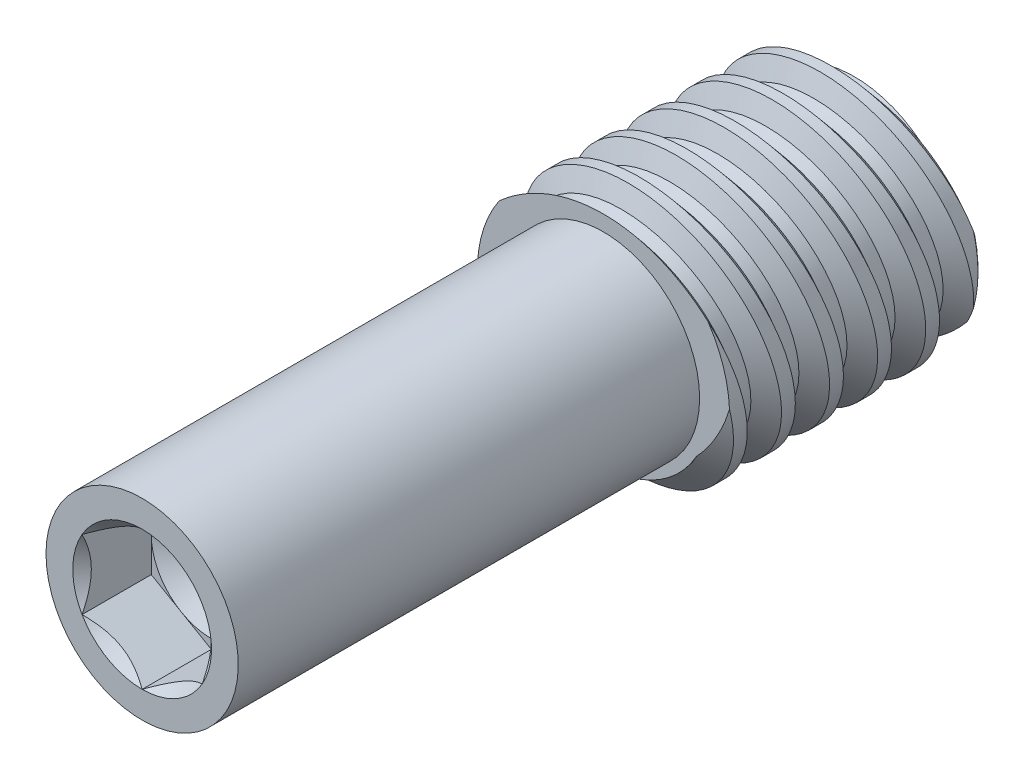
SolidWorks part; units mm, degrees
ref_plane "Front" through (0, 0, 0) normal (0, 0, 1) x (1, 0, 0)
ref_plane "Top" through (0, 0, 0) normal (0, 1, 0) x (1, 0, 0)
ref_plane "Right" through (0, 0, 0) normal (1, 0, 0) x (0, 0, -1)
sketch "Sketch22" plane through (0, 0, 0) normal (1, 0, 0) x (0, 0, -1)
  line L0 (-6.0181, 0) -> (-6.0181, 1.6662)
  line L1 (-6.0181, 1.6662) -> (-5.7264, 2.0828)
  line L2 (-5.7264, 2.0828) -> (5.704, 2.0828)
  line L3 (5.704, 2.0828) -> (6.6819, 1.1049)
  line L4 (6.6819, 1.1049) -> (6.0181, 0)
  line L5 (6.0181, 0) -> (-6.0181, 0)
  line L6 (6.0181, 0) -> (6.6819, 0) construction
  line L7 (6.6819, 0) -> (6.6819, 1.1049) construction
  line L8 (6.6819, -1.1049) -> (6.0181, 0) construction
  line L9 (-5.7264, -2.0828) -> (5.704, -2.0828) construction
  dimension "Screw Dia" = 4.1656
  dimension "Length" = 12.7
  dimension "D3" = 35
  dimension "Cup Point Dia" = 2.2098
  dimension "D5" = 118
  dimension "D6" = 45
  dimension "D7" = 3.3325
revolve "Revolve1" add sketch "Sketch22" angle 360 about L6
sketch "Sketch6" plane through (0, 0, 0) normal (1, 0, 0) x (0, 0, -1)
  line L0 (4.4558, 2.0828) -> (5.2495, -2.0828) construction
  line L1 (-5.7264, 2.0828) -> (5.704, 2.0828) construction
  line L2 (-5.7264, -2.0828) -> (5.704, -2.0828) construction
  line L3 (4.4558, 2.0828) -> (4.5532, 2.1014) construction
  line L4 (5.0723, 1.7629) -> (4.8773, 1.7258)
  line L5 (4.8773, 1.7258) -> (4.5532, 2.1014)
  line L6 (5.0723, 1.7629) -> (5.2355, 2.2314)
  line L7 (5.2355, 2.2314) -> (4.5532, 2.1014)
  line L8 (4.9103, 2.0828) -> (5.704, -2.0828) construction
  line L9 (6.1586, 0.1622) -> (4.4558, -0.1622) construction
  line L10 (4.8944, 2.1664) -> (4.9748, 1.7443) construction
  line L13 (4.4558, -2.0828) -> (4.4558, 2.0828) construction
  line L14 (4.4558, -2.0828) -> (5.2495, -2.0828) construction
  line L15 (5.2495, -2.0828) -> (5.704, -2.0828) construction
  line L18 (4.4558, 2.0828) -> (4.9103, 2.0828) construction
  point P18 (5.3072, 0)
  dimension "D1" = 0.7937
  dimension "D2" = 0.1984
  dimension "D3" = 60
  dimension "D4" = 0.0992
  dimension "Pitch" = 0.7937
revolve "Cut-Revolve8" cut sketch "Sketch6" angle 360 about L9
pattern_linear "LPattern1" count 15 spacing 0.7937 along (0, 0, 1) count 2 spacing 0.7937 along (0, 0, -1) of "Cut-Revolve8"
sketch "Sketch23" plane through (0, 0, 6.0181) normal (0, 0, 1) x (1, 0, 0)
  line L1 (0, 1.1457) -> (-0.9922, 0.5728)
  line L2 (-0.9922, 0.5728) -> (-0.9922, -0.5728)
  line L3 (-0.9922, -0.5728) -> (0, -1.1457)
  line L4 (0, -1.1457) -> (0.9922, -0.5728)
  line L5 (0.9922, -0.5728) -> (0.9922, 0.5728)
  line L6 (0.9922, 0.5728) -> (0, 1.1457)
  circle A0 centre (0, 0) radius 0.9922 construction
  dimension "Hex" = 1.9844
extrude "Cut-Extrude10" cut sketch "Sketch23" against normal blind 1.143
sketch "Sketch24" plane through (0, 0, 6.0181) normal (0, 0, 1) x (1, 0, 0)
  circle A0 centre (0, 0) radius 1.1457
extrude "Cut-Extrude11" cut sketch "Sketch24" against normal through all draft 45
sketch "Sketch26" plane through (0, 0, 4.8751) normal (0, 0, 1) x (1, 0, 0)
  circle A0 centre (0, 0) radius 0.9922 construction
  circle A1 centre (0, 0) radius 0.9922
extrude "Cut-Extrude12" cut sketch "Sketch26" against normal through all draft 59
sketch "Sketch27" plane through (0, 0, 0) normal (1, 0, 0) x (0, 0, -1)
  line L0 (0, 0) -> (-7.6287, 0) construction
  line L1 (1.6019, 3.9772) -> (1.6019, -3.4231) construction
  line L2 (-6.0181, 1.6662) -> (-6.0181, -1.6662) construction
  line L3 (5.7421, 4.1868) -> (5.7421, -3.4231) construction
  line L4 (1.6019, 3.7049) -> (-6.7273, 3.7049)
  line L5 (1.6019, 3.7049) -> (1.6019, 1.5875)
  line L6 (1.6019, 1.5875) -> (-6.7273, 1.5875)
  line L7 (-6.7273, 3.7049) -> (-6.7273, 1.5875)
  line L9 (7.5493, 3.4112) -> (5.7421, 3.4112)
  line L10 (7.5493, 3.4112) -> (7.5493, 0)
  line L11 (7.5493, 0) -> (5.7421, 0)
  line L12 (5.7421, 3.4112) -> (5.7421, 0)
  dimension "D1" = 7.62
  dimension "D2" = 1.5875
  dimension "D3" = 11.7602
revolve "Cut-Revolve9" cut sketch "Sketch27" angle 360 about L0
equation "\"D2@Sketch6\"=\"Pitch@Sketch6\"/4"
equation "\"D4@Sketch6\"=\"Pitch@Sketch6\"/8"
equation "\"D1@Sketch6\"=\"Pitch@Sketch6\""
equation "\"D3@LPattern1\"=\"Pitch@Sketch6\""
equation "\"D1@LPattern1\"=(\"Length@Sketch22\"/\"Pitch@Sketch6\")-1"
equation "\"D4@LPattern1\"=\"Pitch@Sketch6\""
equation "\"D7@Sketch22\"=\"Screw Dia@Sketch22\"*.8"
